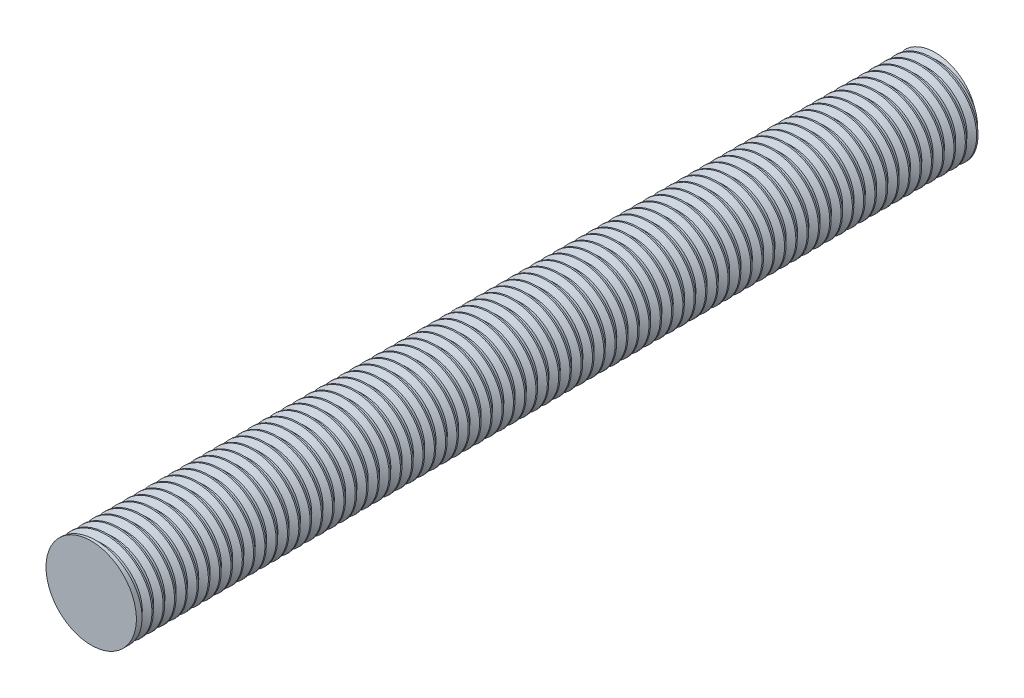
SolidWorks part; units mm, degrees
ref_plane "Front Plane" through (0, 0, 0) normal (0, 0, 1) x (1, 0, 0)
ref_plane "Top Plane" through (0, 0, 0) normal (0, 1, 0) x (1, 0, 0)
ref_plane "Right Plane" through (0, 0, 0) normal (1, 0, 0) x (0, 0, -1)
sketch "Sketch1" plane through (0, 0, 0) normal (0, 0, 1) x (1, 0, 0)
  circle A0 centre (0, 0) radius 3.2
  dimension "D1" = 6.4
extrude "Boss-Extrude1" add sketch "Sketch1" along normal blind 60
thread "Thread1" pitch 0.8 start angle 0, offset 0, length 60, pitch 0.8, diameter 6.4
ref_plane "Plane1" through (-3.2, 0, 60) normal (0, -1, 0) x (-1, 0, 0)
sketch "Thread Profile1" plane through (-3.2, 0, 60) normal (0, -1, 0) x (-1, 0, 0)
  line L0 (0, 0) -> (0, 0.8) construction
  line L11 (0, 0) -> (0, 0.7)
  line L12 (0, 0.7) -> (-0.433, 0.45)
  line L13 (-0.433, 0.45) -> (-0.433, 0.25)
  line L15 (-0.433, 0.25) -> (0, 0)
  line L17 (-0.433, 0.35) -> (0, 0.35) construction
  point P2 (0, 0)
  dimension "Pitch" = 0.8
  dimension "Profile_Angle" = 60
  dimension "Profile_Land" = 0.2
  dimension "Profile_Height" = 0.433
